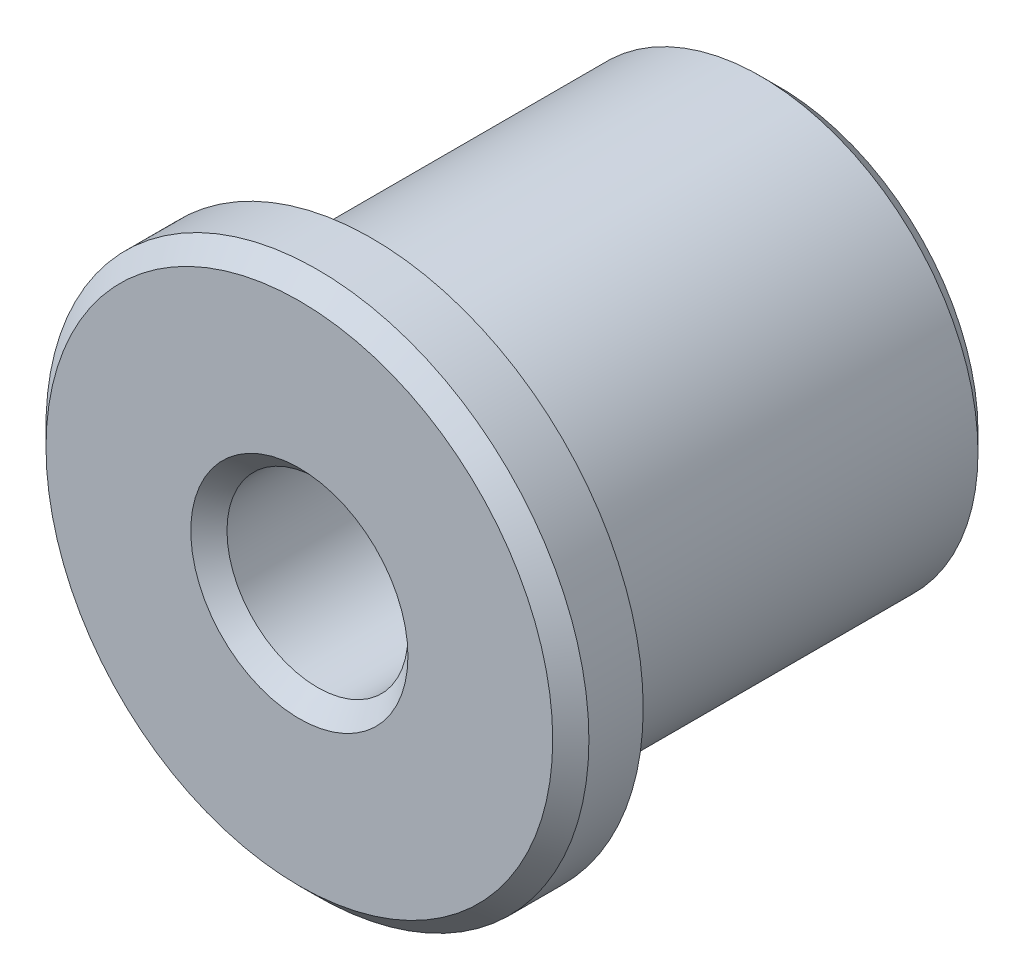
SolidWorks part; units mm, degrees
ref_plane "Plan de face" through (0, 0, 0) normal (0, 0, 1) x (1, 0, 0)
ref_plane "Plan de dessus" through (0, 0, 0) normal (0, 1, 0) x (1, 0, 0)
ref_plane "Plan de droite" through (0, 0, 0) normal (1, 0, 0) x (0, 0, -1)
sketch "Esquisse1" plane through (0, 0, 0) normal (0, 0, 1) x (1, 0, 0)
  circle A0 centre (0, 0) radius 5
  circle A1 centre (0, 0) radius 12
  dimension "D1" = 24
  dimension "D2" = 10
extrude "Boss.-Extru.1" add sketch "Esquisse1" along normal blind 22.5
sketch "Esquisse2" plane through (0, 0, 22.5) normal (0, 0, 1) x (1, 0, 0)
  circle A0 centre (0, 0) radius 5
  circle A1 centre (0, 0) radius 15
  circle A2 centre (0, 0) radius 5 construction
  dimension "D1" = 30
extrude "Boss.-Extru.2" add sketch "Esquisse2" along normal blind 4
chamfer "Chanfrein1" distance 1 angle 45 4 edges at (5, 0, 0) (12, 0, 0) (5, 0, 26.5) (15, 0, 26.5)
